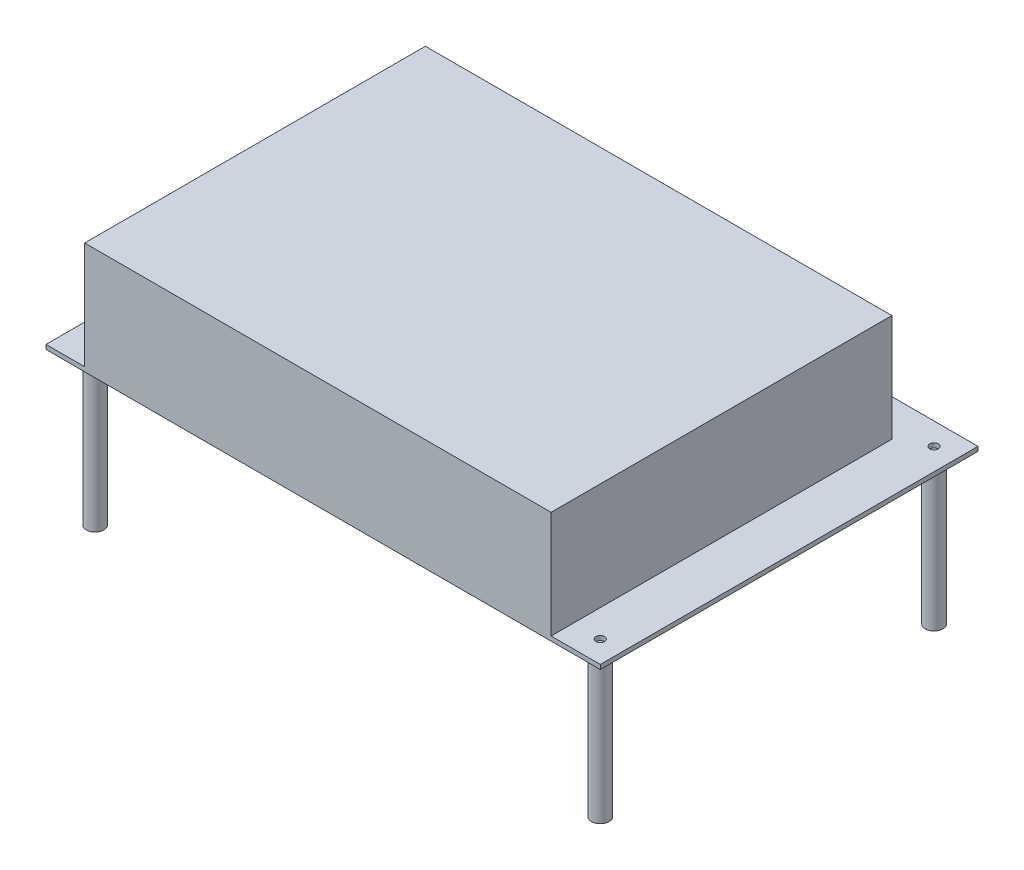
SolidWorks part; units mm, degrees
ref_plane "Front Plane" through (0, 0, 0) normal (0, 0, 1) x (1, 0, 0)
ref_plane "Top Plane" through (0, 0, 0) normal (0, 1, 0) x (1, 0, 0)
ref_plane "Right Plane" through (0, 0, 0) normal (1, 0, 0) x (0, 0, -1)
sketch "Sketch1" plane through (0, 0, 0) normal (0, 1, 0) x (1, 0, 0)
  line L0 (0, 0) -> (160.274, 0)
  line L1 (0, 0) -> (0, 109.22)
  line L2 (160.274, 0) -> (160.274, 109.22)
  line L3 (0, 109.22) -> (160.274, 109.22)
  dimension "D1" = 109.22
  dimension "D2" = 160.274
extrude "Boss-Extrude1" add sketch "Sketch1" along normal blind 1.27
sketch "Sketch2" plane through (0, 1.27, 0) normal (0, 1, 0) x (1, 0, 0)
  line L0 (11.176, 0) -> (146.05, 0)
  line L1 (11.176, 0) -> (11.176, 98.5329)
  line L2 (146.05, 0) -> (146.05, 98.5329)
  line L3 (11.176, 98.5329) -> (146.05, 98.5329)
  line L4 (0, 0) -> (160.274, 0) construction
  line L5 (160.274, 0) -> (160.274, 109.22) construction
  line L6 (0, 109.22) -> (0, 0) construction
  dimension "D1" = 14.224
  dimension "D2" = 11.176
extrude "Boss-Extrude2" add sketch "Sketch2" along normal blind 30.988
sketch "Sketch3" plane through (0, 0, 0) normal (0, -1, 0) x (1, 0, 0)
  line L0 (160.274, 0) -> (160.274, -109.22) construction
  line L1 (0, 0) -> (160.274, 0) construction
  line L2 (160.274, -109.22) -> (0, -109.22) construction
  circle A0 centre (153.924, -6.35) radius 1.25
  circle A1 centre (153.924, -102.87) radius 1.25
  dimension "D1" = 6.35
  dimension "D3" = 6.35
  dimension "D2" = 6.35
  dimension "D4" = 6.35
extrude "Cut-Extrude1" cut sketch "Sketch3" against normal blind 30.988
sketch "Sketch4" plane through (0, 0, 0) normal (0, -1, 0) x (1, 0, 0)
  line L0 (0, 0) -> (160.274, 0) construction
  line L1 (160.274, -109.22) -> (0, -109.22) construction
  circle A0 centre (7.874, -6.35) radius 1.25
  circle A1 centre (153.924, -6.35) radius 1.25 construction
  circle A2 centre (7.874, -102.87) radius 1.25
  dimension "D1" = 6.35
  dimension "D3" = 6.35
  dimension "D2" = 146.05
extrude "Cut-Extrude2" cut sketch "Sketch4" against normal blind 30.988
sketch "Sketch5" plane through (0, 0, 0) normal (0, -1, 0) x (1, 0, 0)
  circle A0 centre (7.874, -6.35) radius 2.54
  circle A1 centre (153.924, -6.35) radius 2.54
  circle A2 centre (7.874, -102.87) radius 2.54
  circle A3 centre (153.924, -102.87) radius 2.54
extrude "Boss-Extrude3" add sketch "Sketch5" along normal blind 43.18
